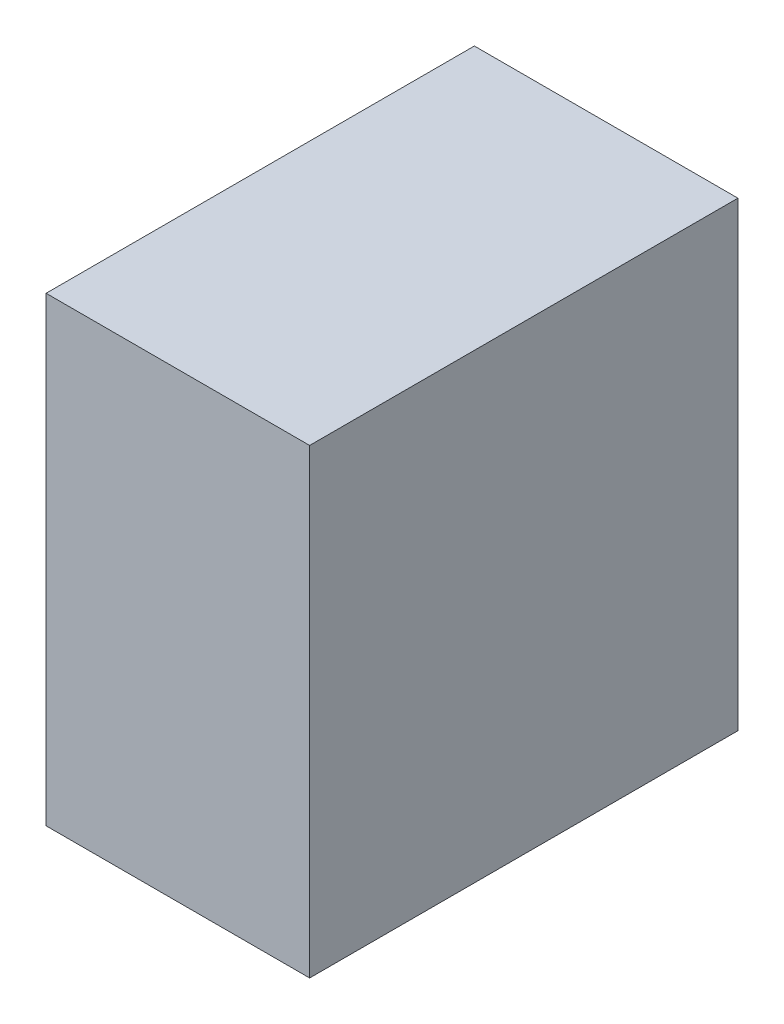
SolidWorks part; units mm, degrees
ref_plane "Plan de face" through (0, 0, 0) normal (0, 0, 1) x (1, 0, 0)
ref_plane "Plan de dessus" through (0, 0, 0) normal (0, 1, 0) x (1, 0, 0)
ref_plane "Plan de droite" through (0, 0, 0) normal (1, 0, 0) x (0, 0, -1)
sketch "Esquisse1" plane through (0, 0, 0) normal (0, 0, 1) x (1, 0, 0)
  line L1 (-38.4705, 26.2979) -> (-30.4705, 26.2979)
  line L2 (-38.4705, 26.2979) -> (-38.4705, 12.2979)
  line L3 (-38.4705, 12.2979) -> (-30.4705, 12.2979)
  line L4 (-30.4705, 26.2979) -> (-30.4705, 12.2979)
  dimension "D1" = 8
  dimension "D2" = 14
extrude "Boss.-Extru.1" add sketch "Esquisse1" along normal blind 13
